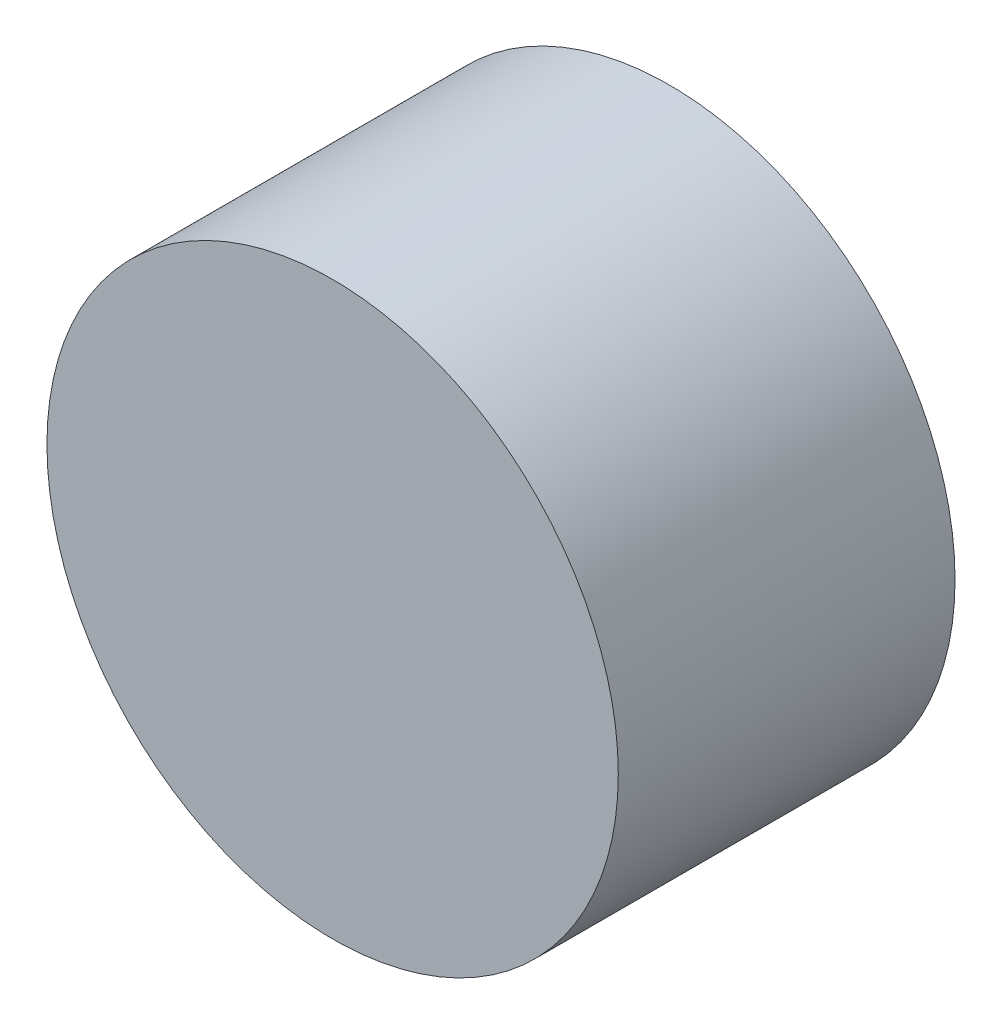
SolidWorks part; units mm, degrees
ref_plane "Front" through (0, 0, 0) normal (0, 0, 1) x (1, 0, 0)
ref_plane "Top" through (0, 0, 0) normal (0, 1, 0) x (1, 0, 0)
ref_plane "Right" through (0, 0, 0) normal (1, 0, 0) x (0, 0, -1)
sketch "Sketch1" plane through (0, 0, 0) normal (0, 0, 1) x (1, 0, 0)
  circle A0 centre (0, 0) radius 1.2497
  dimension "D1" = 2.4994
extrude "Extrude1" add sketch "Sketch1" along normal blind 1.4732
